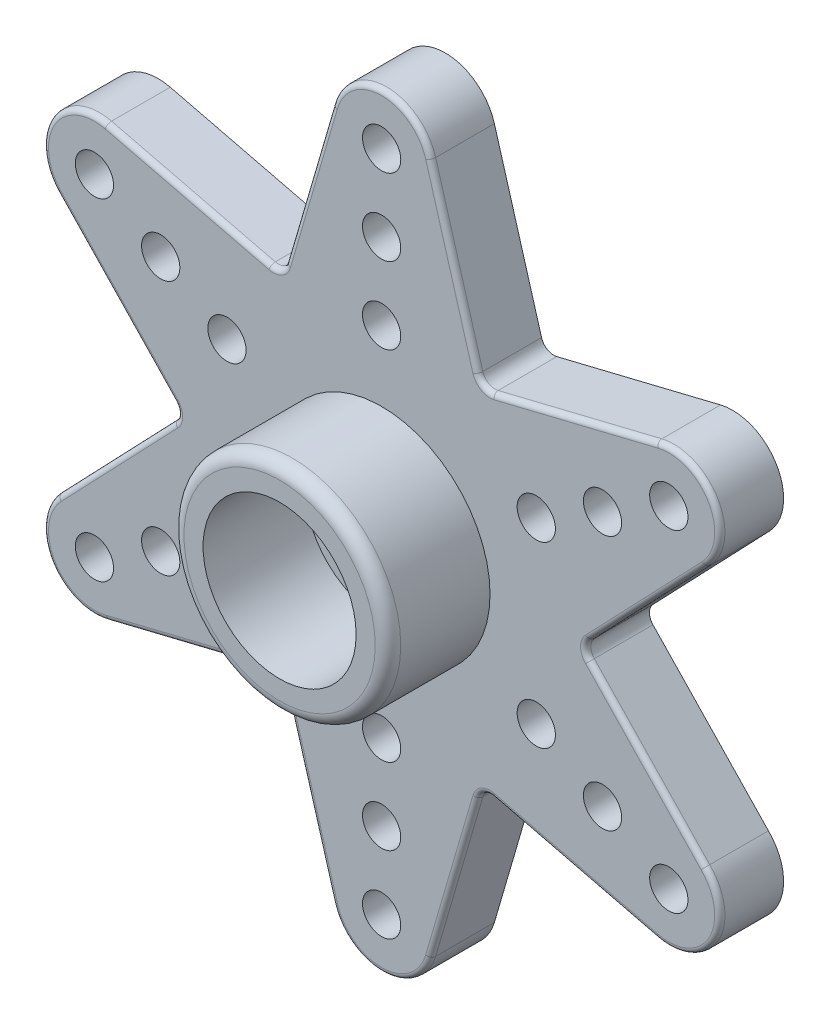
SolidWorks part; units mm, degrees
ref_plane "Front Plane" through (0, 0, 0) normal (0, 0, 1) x (1, 0, 0)
ref_plane "Top Plane" through (0, 0, 0) normal (0, 1, 0) x (1, 0, 0)
ref_plane "Right Plane" through (0, 0, 0) normal (1, 0, 0) x (0, 0, -1)
sketch "Sketch1" plane through (0, 0, 0) normal (0, 0, 1) x (1, 0, 0)
  line L0 (12.6639, -5.0772) -> (8.1379, -0.3458)
  line L1 (10.7835, -8.4428) -> (4.3684, -6.8751)
  line L2 (-10.7289, -8.4287) -> (-4.3684, -6.8748)
  line L3 (-12.7035, -5.1174) -> (-8.1382, -0.3456)
  line L4 (-10.7858, 8.4434) -> (-4.3682, 6.8749)
  line L5 (1.9199, 13.5602) -> (3.7698, 7.2207)
  line L6 (-1.935, 13.5058) -> (-3.7695, 7.2205)
  line L7 (-12.7051, 5.1191) -> (-8.1382, 0.3457)
  line L8 (12.7051, 5.1191) -> (8.138, 0.3455)
  line L9 (1.9193, -13.5625) -> (3.7697, -7.2207)
  line L10 (-1.9193, -13.5625) -> (-3.7698, -7.2205)
  line L11 (10.7858, 8.4434) -> (4.3685, 6.875)
  arc A0 (1.9199, 13.5602) -> (-1.935, 13.5058) centre (0, 13) ccw
  arc A1 (10.7835, -8.4428) -> (12.6639, -5.0772) centre (11.2583, -6.5) ccw
  arc A2 (-1.9193, -13.5625) -> (1.9193, -13.5625) centre (0, -13) ccw
  arc A3 (-8.1382, -0.3456) -> (-8.1382, 0.3457) centre (-8.4995, 0.0001) ccw
  arc A4 (-3.7698, -7.2205) -> (-4.3684, -6.8748) centre (-4.2497, -7.3605) ccw
  circle A5 centre (11.2583, -6.5) radius 0.75
  circle A6 centre (8.6603, -5) radius 0.75
  circle A7 centre (6.0622, -3.5) radius 0.75
  arc A8 (-12.7035, -5.1174) -> (-10.7289, -8.4287) centre (-11.2583, -6.5) ccw
  circle A9 centre (-11.2583, -6.5) radius 0.75
  circle A10 centre (-8.6603, -5) radius 0.75
  circle A11 centre (-6.0622, -3.5) radius 0.75
  circle A12 centre (-8.6603, 5) radius 0.75
  circle A13 centre (-6.0622, 3.5) radius 0.75
  circle A14 centre (-11.2583, 6.5) radius 0.75
  arc A15 (-10.7858, 8.4434) -> (-12.7051, 5.1191) centre (-11.2583, 6.5) ccw
  circle A16 centre (8.6603, 5) radius 0.75
  circle A17 centre (6.0622, 3.5) radius 0.75
  circle A18 centre (0, 7) radius 0.75
  circle A19 centre (0, 10) radius 0.75
  circle A20 centre (0, 13) radius 0.75
  circle A21 centre (11.2583, 6.5) radius 0.75
  circle A22 centre (0, 0) radius 1.5
  arc A23 (12.7051, 5.1191) -> (10.7858, 8.4434) centre (11.2583, 6.5) ccw
  arc A24 (3.7697, -7.2207) -> (4.3684, -6.8751) centre (4.2497, -7.3608) cw
  arc A25 (8.138, 0.3455) -> (8.1379, -0.3458) centre (8.4993, -0.0001) ccw
  arc A26 (3.7698, 7.2207) -> (4.3685, 6.875) centre (4.2498, 7.3607) ccw
  arc A27 (-4.3682, 6.8749) -> (-3.7695, 7.2205) centre (-4.2495, 7.3606) ccw
  circle A28 centre (0, -13) radius 0.75
  circle A29 centre (0, -10) radius 0.75
  circle A30 centre (0, -7) radius 0.75
  arc A35 (13.5625, -1.9193) -> (13.5625, 1.9193) centre (13, 0) ccw
  circle A37 centre (13, 0) radius 0.75
  circle A38 centre (10, 0) radius 0.75
  arc A39 (-13.5625, 1.9193) -> (-13.5625, -1.9193) centre (-13, 0) ccw
  circle A41 centre (-13, 0) radius 0.75
  circle A42 centre (-10, 0) radius 0.75
  circle A43 centre (-7, 0) radius 0.75
  circle A46 centre (7, 0) radius 0.75
  point P36 (0, 0)
  point P66 (0, 0)
  dimension "D2" = 13
  dimension "D4" = 0.5
  dimension "D5" = 13
  dimension "D9" = 7
  dimension "D10" = 1.5
  dimension "D11" = 10
  dimension "D12" = 13
  dimension "D14" = 3
  dimension "D3" = 4
  dimension "D15" = 4
extrude "Boss-Extrude1" add sketch "Sketch1" along normal blind 2.5
sketch "Sketch2" plane through (0, 0, 2.5) normal (0, 0, 1) x (1, 0, 0)
  circle A0 centre (0, 0) radius 4.25
  circle A1 centre (0, 0) radius 3
  dimension "D1" = 8.5
  dimension "D2" = 6
extrude "Boss-Extrude2" add sketch "Sketch2" along normal blind 4
sketch "Sketch3" plane through (0, 0, 0) normal (0, 0, -1) x (-1, 0, 0)
  circle A0 centre (0, 0) radius 4.5
  dimension "D1" = 9
extrude "Cut-Extrude1" cut sketch "Sketch3" against normal blind 0.8
sketch "Sketch4" plane through (0, 0, 0.8) normal (0, 0, -1) x (-1, 0, 0)
  circle A0 centre (0, 0) radius 3.5
  circle A1 centre (0, 0) radius 3.7
  dimension "D1" = 7
  dimension "D2" = 0.2
extrude "Boss-Extrude3" add sketch "Sketch4" along normal blind 1
fillet "Fillet2" radius 0.5 1 edges at (4.25, 0, 6.5)
fillet "Fillet3" radius 0.2 24 edges at (2.8445, -10.3916, 2.5) (0, -15, 2.5) (-2.8445, -10.3915, 2.5) (-2.8523, 10.3632, 2.5) (-0.0282, 14.9998, 2.5) (2.8449, 10.3904, 2.5) (-12.9904, 7.5, 2.5) (-7.577, 7.6592, 2.5) (12.9904, 7.5, 2.5) (7.5772, 7.6592, 2.5) (13.0043, -7.4755, 2.5) (-12.9761, -7.5243, 2.5) (10.4009, -2.7115, 2.5) (10.4215, 2.7323, 2.5) (7.576, -7.659, 2.5) (-10.4216, 2.7324, 2.5) (-10.4208, -2.7315, 2.5) (-7.5487, -7.6517, 2.5) (7.9993, -0.0001, 2.5) (3.9998, 6.9277, 2.5) (-3.9995, 6.9276, 2.5) (-7.9995, 0.0001, 2.5) (-3.9997, -6.9275, 2.5) (3.9997, -6.9278, 2.5)
